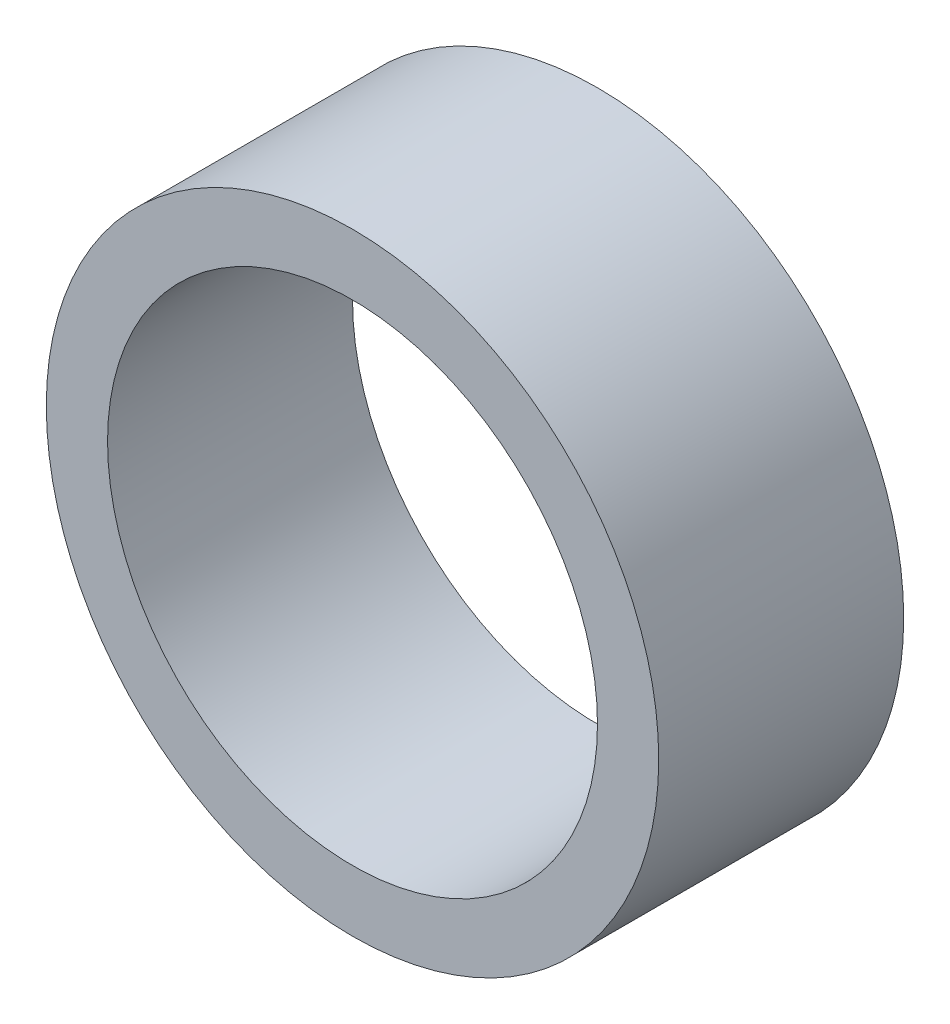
SolidWorks part; units mm, degrees
ref_plane "Front Plane" through (0, 0, 0) normal (0, 0, 1) x (1, 0, 0)
ref_plane "Top Plane" through (0, 0, 0) normal (0, 1, 0) x (1, 0, 0)
ref_plane "Right Plane" through (0, 0, 0) normal (1, 0, 0) x (0, 0, -1)
sketch "Sketch1" plane through (0, 0, 0) normal (0, 0, 1) x (1, 0, 0)
  circle A0 centre (0, 0) radius 20
  circle A1 centre (0, 0) radius 25
  dimension "D1" = 40
  dimension "D2" = 5
extrude "Extrude1" add sketch "Sketch1" along normal blind 20
